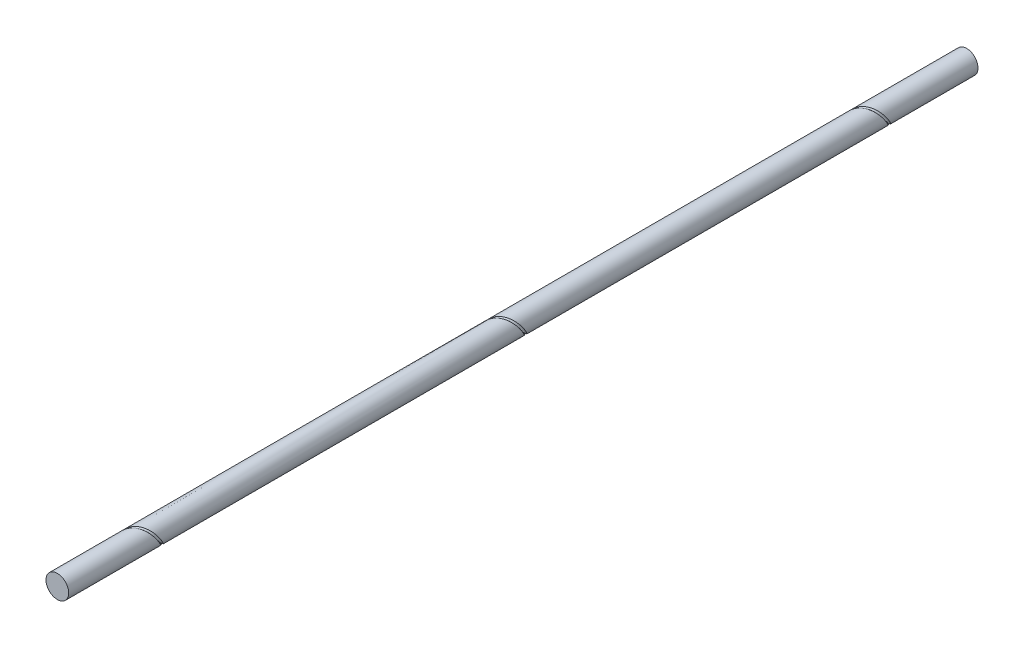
SolidWorks part; units mm, degrees
ref_plane "Front Plane" through (0, 0, 0) normal (0, 0, 1) x (1, 0, 0)
ref_plane "Top Plane" through (0, 0, 0) normal (0, 1, 0) x (1, 0, 0)
ref_plane "Right Plane" through (0, 0, 0) normal (1, 0, 0) x (0, 0, -1)
sketch "Sketch1" plane through (0, 0, 0) normal (0, 0, 1) x (1, 0, 0)
  circle A0 centre (0, 0) radius 25
  dimension "D1" = 50
extrude "Boss-Extrude1" add sketch "Sketch1" along normal blind 2000
ref_plane "Plane1" through (0, 0, 150) normal (0, 0, 1) x (1, 0, 0)
sketch "Sketch2" plane through (0, 0, 150) normal (0, 0, 1) x (1, 0, 0)
  circle A0 centre (0, 0) radius 27.646
  dimension "D1" = 55.292
curve "Helix/Spiral1"
sketch "Sketch3" plane through (0, 0, 0) normal (0, 1, 0) x (1, 0, 0)
  circle A0 centre (-27.646, -150) radius 3.969
  spline S0 degree 3 poles (-27.646, -150) (-27.646, -151.3307) (-27.0608, -154.0012) (-24.4828, -157.9997) (-20.3663, -162.0001) (-14.9702, -166) (-8.6335, -170) (-1.7543, -174) (5.2352, -178) (11.8957, -182) (17.8087, -186) (22.6028, -190) (25.9766, -194) (27.7183, -198) (27.7183, -202) (25.9766, -206) (22.6028, -210) (17.8087, -214) (11.8957, -218) (5.2352, -222) (-1.7543, -226) (-8.6335, -230) (-14.9702, -234) (-20.3663, -237.9999) (-24.4828, -242.0003) (-27.0608, -245.9988) (-27.646, -248.6693) (-27.646, -250) knots 0 0 0 0 0.04 0.08 0.12 0.16 0.2 0.24 0.28 0.32 0.36 0.4 0.44 0.48 0.52 0.56 0.6 0.64 0.68 0.72 0.76 0.8 0.84 0.88 0.92 0.96 1 1 1 1 construction
  dimension "D1" = 7.938
sweep "Cut-Sweep1" cut profiles "Sketch3" path "Helix/Spiral1"
pattern_linear "LPattern1" count 3 spacing 800 along (0, 0, -1) of "Cut-Sweep1"
